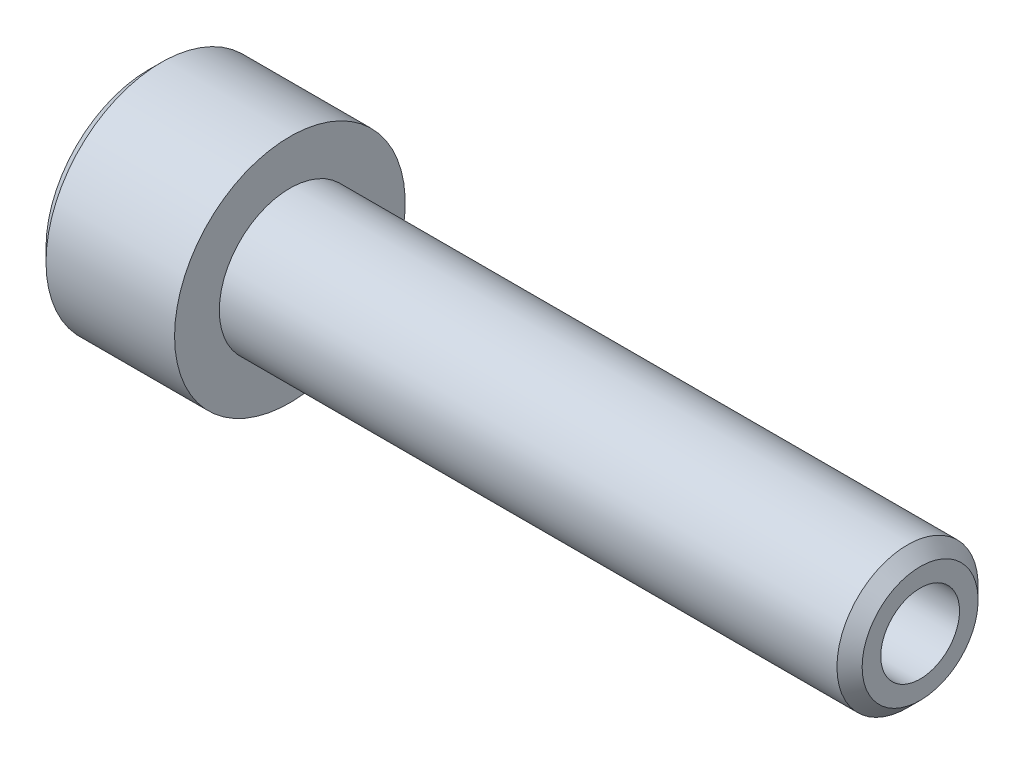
SolidWorks part; units mm, degrees
ref_plane "Plane1" through (0, 0, 0) normal (0, 0, 1) x (1, 0, 0)
ref_plane "Plane2" through (0, 0, 0) normal (0, 1, 0) x (1, 0, 0)
ref_plane "Plane3" through (0, 0, 0) normal (1, 0, 0) x (0, 0, -1)
sketch "Sketch1" plane through (0, 0, 0) normal (0, 0, 1) x (1, 0, 0)
  line L0 (0, 1.4224) -> (12.446, 1.4224)
  line L1 (12.446, 1.4224) -> (12.7, 1.1684)
  line L2 (12.7, 1.1684) -> (12.7, 0)
  line L3 (0, 1.4224) -> (0, 2.3241)
  line L4 (0, 2.3241) -> (-2.5908, 2.3241)
  line L5 (-2.5908, 2.3241) -> (-2.8448, 2.0701)
  line L6 (-2.8448, 2.0701) -> (-2.8448, 0)
  line L7 (-52.8448, 0) -> (217.1552, 0) construction
  line L8 (12.7, 0) -> (-2.8448, 0)
  dimension "D1" = 4.6482
  dimension "S_Chamfer" = 0.254
  dimension "S2" = 0.254
  dimension "H_HeadHight" = 2.8448
  dimension "L_BodyLength" = 12.7
  dimension "S3" = 0.254
  dimension "S4" = 0.254
  dimension "H2" = 2.8448
  dimension "L2" = 12.7
  dimension "D_BodyDiameter" = 2.8448
revolve "Base-Revolve" add sketch "Sketch1" angle 360 about L7
sketch "Sketch3" plane through (-2.8448, 0, 0) normal (-1, 0, 0) x (0, 0, 1)
  line L0 (-0.6874, 1.1906) -> (0.6874, 1.1906)
  line L1 (0.6874, 1.1906) -> (1.3748, 0)
  line L2 (-0.6874, 1.1906) -> (-1.3748, 0)
  line L3 (-0.6874, -1.1906) -> (0.6874, -1.1906)
  line L4 (0.6874, -1.1906) -> (1.3748, 0)
  line L5 (-0.6874, -1.1906) -> (-1.3748, 0)
  line L6 (1.3748, 0) -> (-1.3748, 0) construction
  line L7 (-0.6874, 1.1906) -> (0.6874, -1.1906) construction
  line L8 (0.6874, 1.1906) -> (-0.6874, -1.1906) construction
  line L9 (0, 2.0701) -> (0, -2.0701) construction
  line L10 (-2.0701, 0) -> (2.0701, 0) construction
  circle A1 centre (0, 0) radius 2.0701 construction
  point P1 (0, 0)
  point P15 (0, 0)
  dimension "J_HexagonSocketSize" = 2.3813
extrude "Cut-Extrude1" cut sketch "Sketch3" against normal blind 1.7859
hole_wizard "1/16 (0.0625) Diameter Hole1" positions "Sketch5" profile "Sketch4" hole size "1/16" standard "Ansi Inch"
sketch "Sketch5" plane through (12.7, 0, 0) normal (1, 0, 0) x (0, 0, -1)
  point P0 (0, 0)
sketch "Sketch4" plane through (12.7, 0, 0) normal (0, 1, 0) x (0, 0, -1)
  line L0 (0, 0) -> (0, 15.5448)
  line L1 (0, 15.5448) -> (0.7937, 15.5448)
  line L2 (0.7937, 15.5448) -> (0.7937, 0)
  line L5 (0.7937, 0) -> (0, 0)
  line L11 (0, -6.35) -> (0, 107.95) construction
  dimension "Thru Hole Dia." = 1.5875
  dimension "Thru Hole Depth" = 15.5448
equation "\"S2@Sketch1\" = \"S_Chamfer@Sketch1\""
equation "\"S3@Sketch1\" = \"S_Chamfer@Sketch1\""
equation "\"S4@Sketch1\" = \"S_Chamfer@Sketch1\""
equation "\"H2@Sketch1\" = \"H_HeadHight@Sketch1\""
equation "\"L2@Sketch1\" = \"L_BodyLength@Sketch1\""
equation "\"T_KeyEngagement@Cut-Extrude1\" = \"J_HexagonSocketSize@Sketch3\"*.75"
